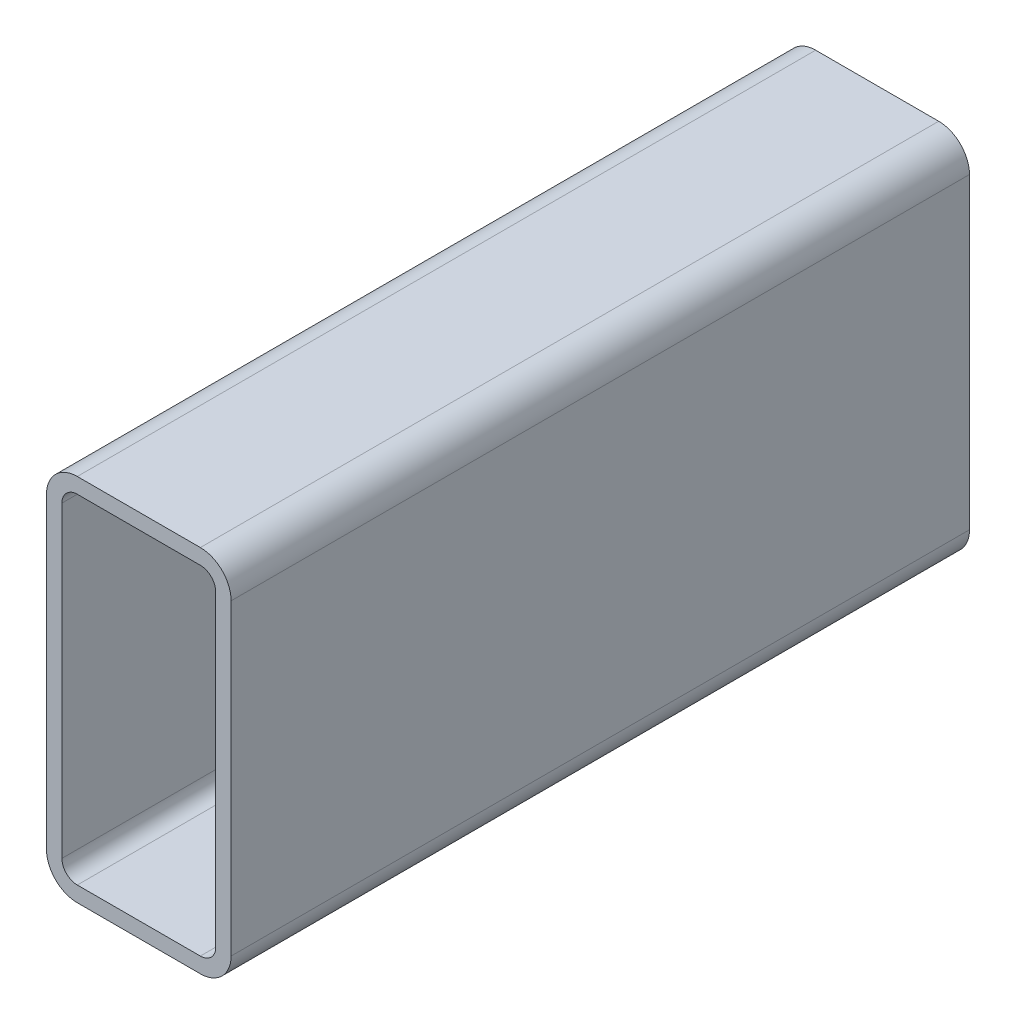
SolidWorks part; units mm, degrees
ref_plane "Front Plane" through (0, 0, 0) normal (0, 0, 1) x (1, 0, 0)
ref_plane "Top Plane" through (0, 0, 0) normal (0, 1, 0) x (1, 0, 0)
ref_plane "Right Plane" through (0, 0, 0) normal (1, 0, 0) x (0, 0, -1)
sketch "Sketch1" plane through (0, 0, 0) normal (0, 0, 1) x (1, 0, 0)
sketch_block_instance "HSS6x3x0.250-1"
sketch_block "HSS6x3x0.250"
extrude "Boss-Extrude1" add sketch "Sketch1" along normal blind 304.8
